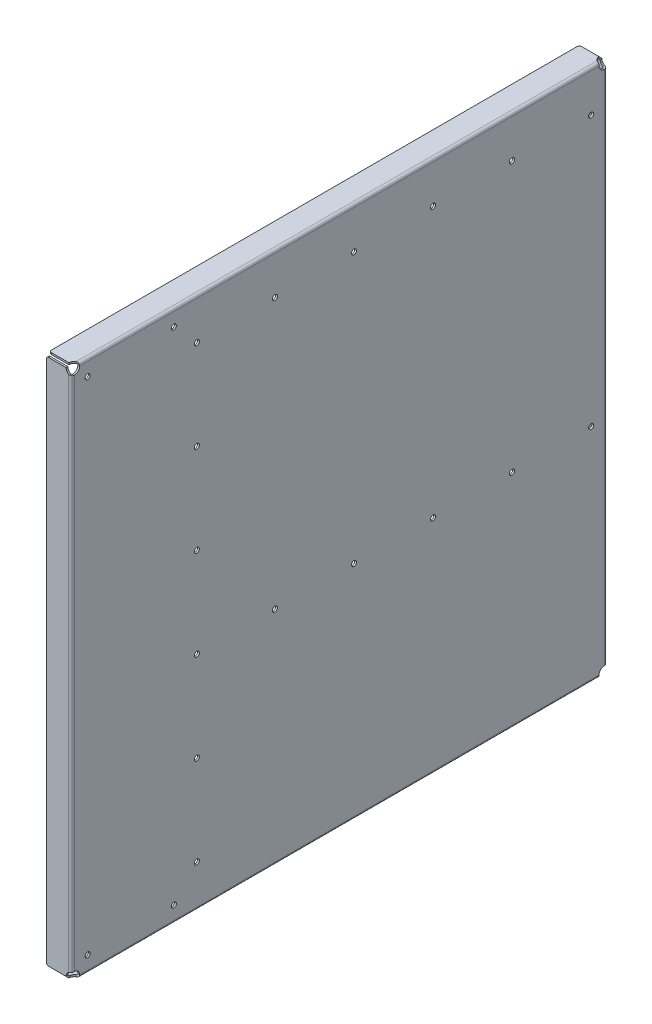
SolidWorks part; units mm, degrees
other "<Left Side Plate>-<M4 Clearance Hole1>"
ref_plane "Front" through (0, 0, 0) normal (0, 0, 1) x (1, 0, 0)
ref_plane "Top" through (0, 0, 0) normal (0, 1, 0) x (1, 0, 0)
ref_plane "Right" through (0, 0, 0) normal (1, 0, 0) x (0, 0, -1)
mirrored part "Left Side Plate_Mirrored"
